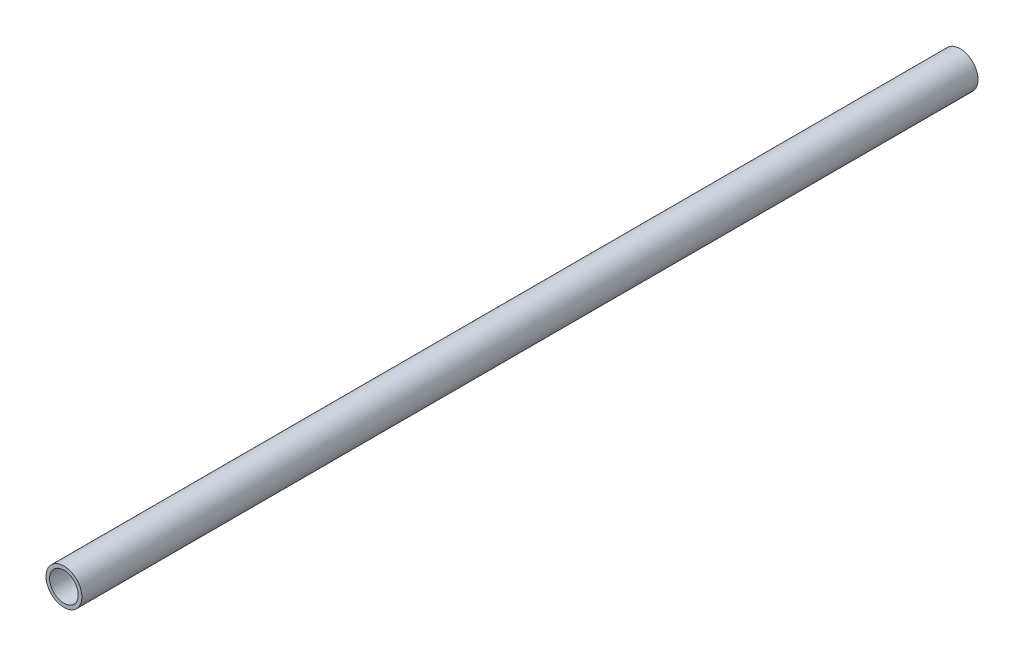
SolidWorks part; units mm, degrees
ref_plane "Front Plane" through (0, 0, 0) normal (0, 0, 1) x (1, 0, 0)
ref_plane "Top Plane" through (0, 0, 0) normal (0, 1, 0) x (1, 0, 0)
ref_plane "Right Plane" through (0, 0, 0) normal (1, 0, 0) x (0, 0, -1)
sketch "Sketch1" plane through (0, 0, 0) normal (0, 0, 1) x (1, 0, 0)
  circle A0 centre (0, 0) radius 12.7
  circle A1 centre (0, 0) radius 10.16
  dimension "D1" = 2.54
extrude "Extrude1" add sketch "Sketch1" along normal blind 635
